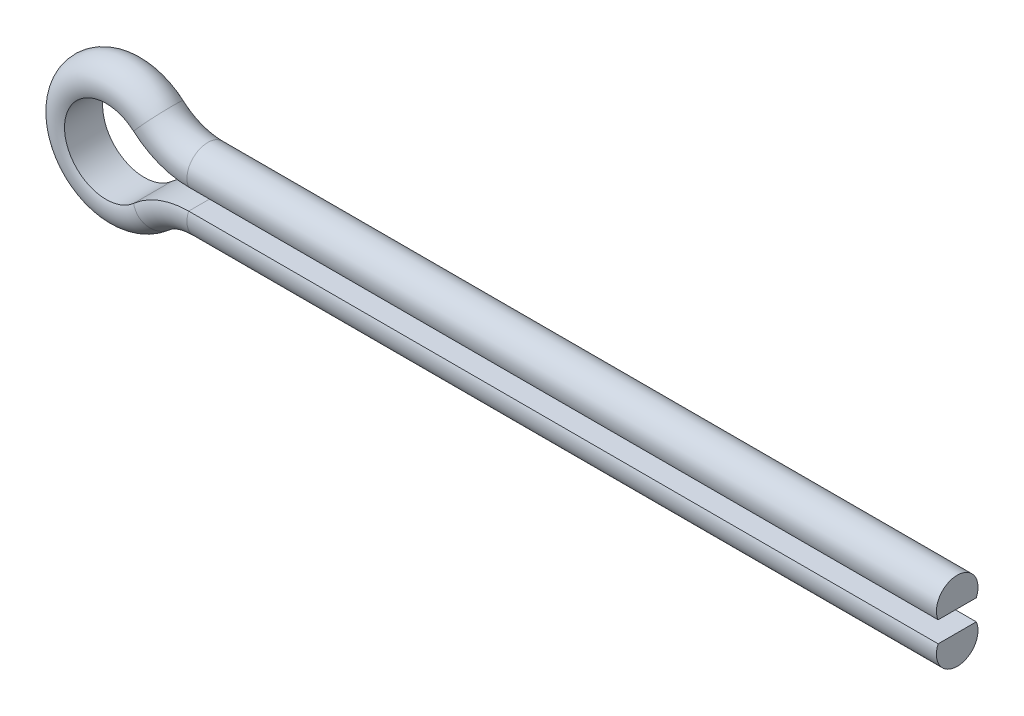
SolidWorks part; units mm, degrees
ref_plane "Front Plane" through (0, 0, 0) normal (0, 0, 1) x (1, 0, 0)
ref_plane "Top Plane" through (0, 0, 0) normal (0, 1, 0) x (1, 0, 0)
ref_plane "Right Plane" through (0, 0, 0) normal (1, 0, 0) x (0, 0, -1)
sketch "Sketch1" plane through (0, 0, 0) normal (0, 0, 1) x (1, 0, 0)
  line L0 (100, 1.25) -> (9.9216, 1.25)
  line L1 (9.9216, -1.25) -> (100, -1.25)
  line L2 (0, 0) -> (107.5598, 0) construction
  arc A0 (9.9216, 1.25) -> (3.3072, 3.75) centre (9.9216, 11.25) cw
  arc A1 (3.3072, 3.75) -> (3.3072, -3.75) centre (0, 0) ccw
  arc A2 (3.3072, -3.75) -> (9.9216, -1.25) centre (9.9216, -11.25) cw
  dimension "D1" = 10
  dimension "D2" = 5
  dimension "D3" = 2.5
  dimension "D4" = 100
ref_plane "Plane1" through (100, 1.25, 0) normal (-1, 0, 0) x (0, 0, 1)
sketch "Sketch2" plane through (100, 1.25, 0) normal (-1, 0, 0) x (0, 0, 1)
  line L0 (2.2913, 0) -> (-2.2913, 0)
  arc A0 (2.2913, 0) -> (-2.2913, 0) centre (0, 1) ccw
  point P1 (0, 0)
  dimension "D1" = 2.5
  dimension "D2" = 3.5
sweep "Sweep1" add profiles "Sketch2" path "Sketch1"
